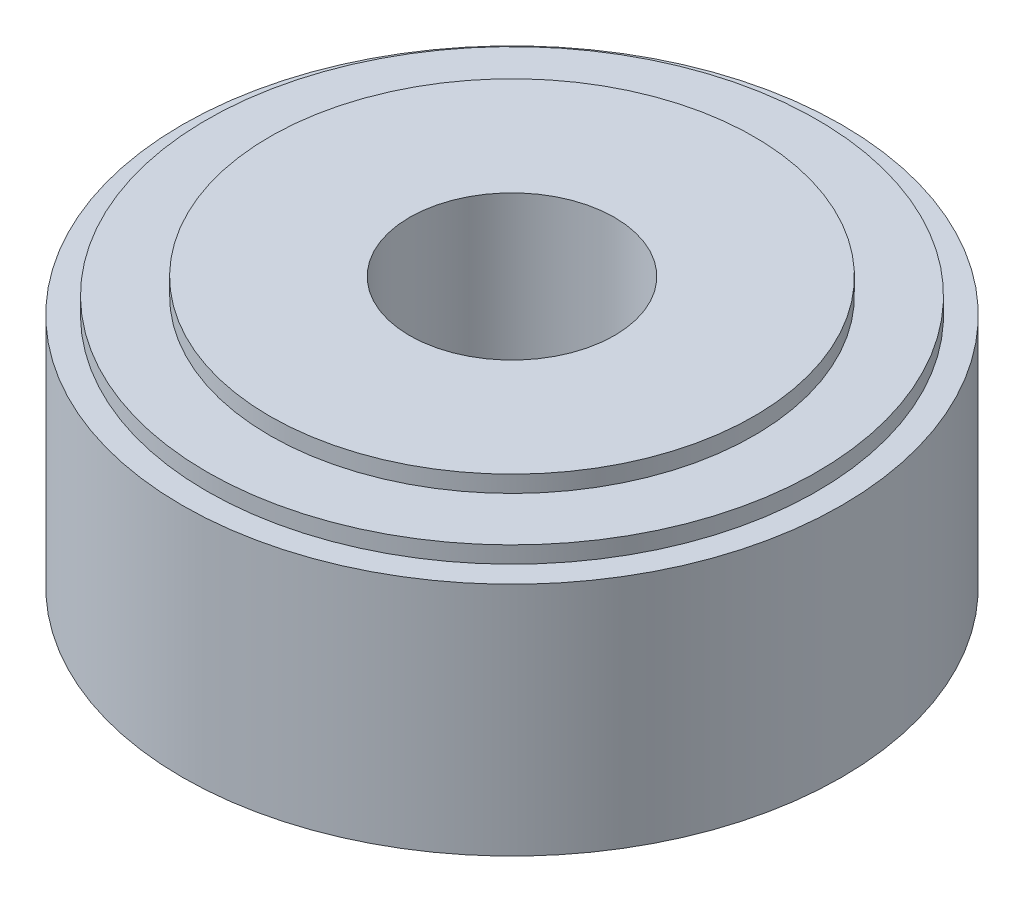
SolidWorks part; units mm, degrees
ref_plane "Front Plane" through (0, 0, 0) normal (0, 0, 1) x (1, 0, 0)
ref_plane "Top Plane" through (0, 0, 0) normal (0, 1, 0) x (1, 0, 0)
ref_plane "Right Plane" through (0, 0, 0) normal (1, 0, 0) x (0, 0, -1)
sketch "Sketch1" plane through (0, 0, 0) normal (0, 1, 0) x (1, 0, 0)
  circle A0 centre (0, 0) radius 19.73
  dimension "D1" = 39.46
extrude "Boss-Extrude1" add sketch "Sketch1" along normal mid plane 14.09
sketch "Sketch2" plane through (0, 7.045, 0) normal (0, 1, 0) x (1, 0, 0)
  circle A0 centre (0, 0) radius 18.26
  dimension "D1" = 36.52
extrude "Boss-Extrude2" add sketch "Sketch2" along normal mid plane 2
sketch "Sketch3" plane through (0, 8.045, 0) normal (0, 1, 0) x (1, 0, 0)
  circle A0 centre (0, 0) radius 14.49
  dimension "D1" = 28.98
extrude "Boss-Extrude3" add sketch "Sketch3" along normal mid plane 2
sketch "Sketch4" plane through (0, 9.045, 0) normal (0, 1, 0) x (1, 0, 0)
  circle A0 centre (0, 0) radius 6.13
  point P3 (0, 0)
  dimension "D1" = 12.26
extrude "Cut-Extrude1" cut sketch "Sketch4" against normal up to next contours A0
